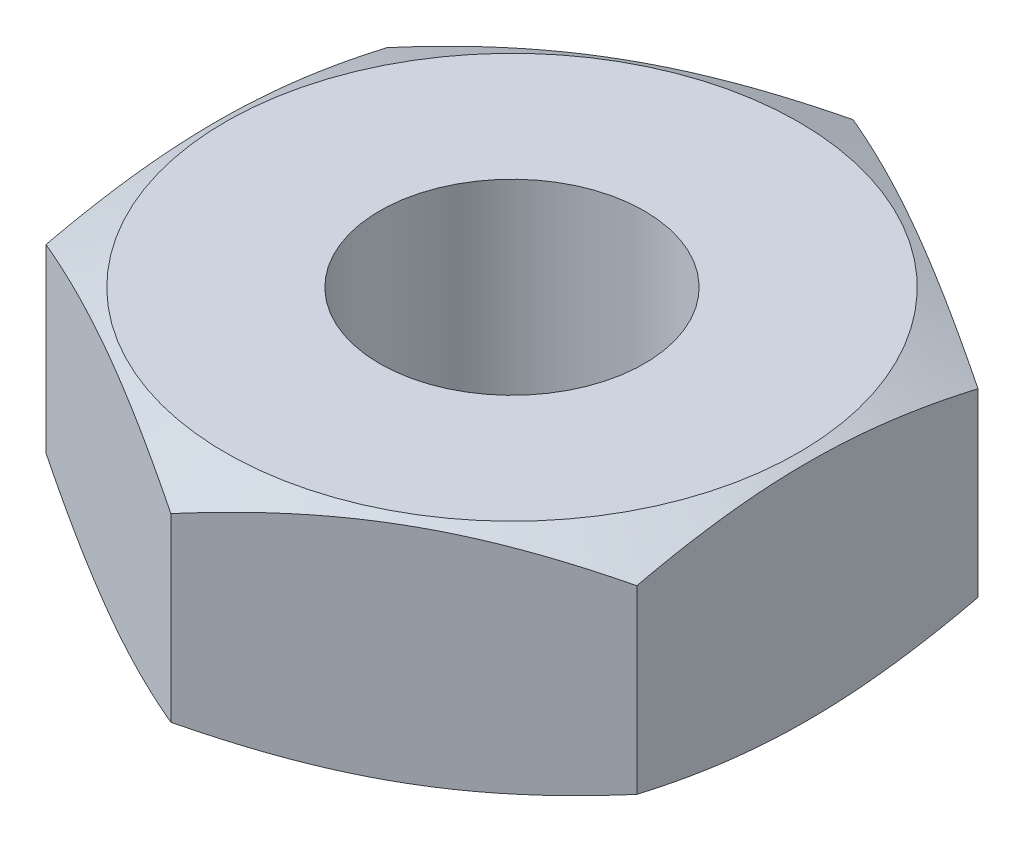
SolidWorks part; units mm, degrees
ref_plane "Front" through (0, 0, 0) normal (0, 0, 1) x (1, 0, 0)
ref_plane "Top" through (0, 0, 0) normal (0, 1, 0) x (1, 0, 0)
ref_plane "Right" through (0, 0, 0) normal (1, 0, 0) x (0, 0, -1)
sketch "Sketch1" plane through (0, 0, 0) normal (0, 0, 1) x (1, 0, 0)
  line L0 (0, -24.892) -> (0, 27.3812) construction
  line L1 (1.4224, 0) -> (1.4224, 2.4892)
  line L2 (1.4224, 2.4892) -> (3.0796, 2.4892)
  line L3 (3.0796, 2.4892) -> (3.6662, 2.2157)
  line L4 (3.6662, 2.2157) -> (3.6662, 0.2735)
  line L5 (3.6662, 0.2735) -> (3.0796, 0)
  line L6 (3.0796, 0) -> (1.4224, 0)
revolve "Base-Revolve" add sketch "Sketch1" angle 360 about L0
sketch "Sketch2" plane through (0, 0, 0) normal (0, 1, 0) x (1, 0, 0)
  line L0 (3.175, 1.8331) -> (0, 3.6662)
  line L1 (0, 3.6662) -> (-3.175, 1.8331)
  line L2 (-3.175, 1.8331) -> (-3.175, -1.8331)
  line L3 (-3.175, -1.8331) -> (0, -3.6662)
  line L4 (0, -3.6662) -> (3.175, -1.8331)
  line L5 (3.175, -1.8331) -> (3.175, 1.8331)
  line L6 (4.0328, 4.0328) -> (-4.0328, 4.0328)
  line L7 (-4.0328, 4.0328) -> (-4.0328, -4.0328)
  line L8 (-4.0328, -4.0328) -> (4.0328, -4.0328)
  line L9 (4.0328, -4.0328) -> (4.0328, 4.0328)
extrude "Cut-Extrude1" cut sketch "Sketch2" along normal blind 2.4892
